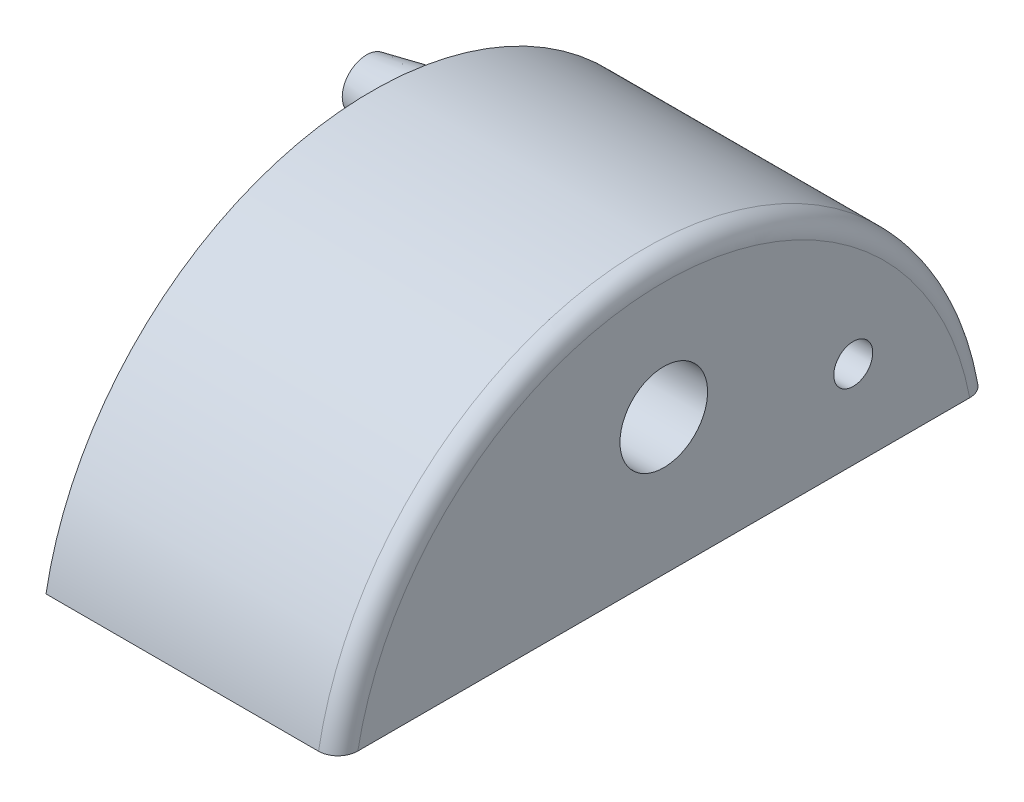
SolidWorks part; units mm, degrees
ref_plane "Front Plane" through (0, 0, 0) normal (0, 0, 1) x (1, 0, 0)
ref_plane "Top Plane" through (0, 0, 0) normal (0, 1, 0) x (1, 0, 0)
ref_plane "Right Plane" through (0, 0, 0) normal (1, 0, 0) x (0, 0, -1)
sketch "Sketch1" plane through (0, 0, 0) normal (1, 0, 0) x (0, 0, -1)
  line L0 (-20, 0) -> (20, 0) construction
  line L1 (-16.7332, 3) -> (16.7332, 3)
  arc A0 (-20, 0) -> (20, 0) centre (0, 0) cw construction
  arc A1 (-16.7332, 3) -> (16.7332, 3) centre (0, 0) cw
  point P4 (0, 0)
  dimension "D1" = 40
  dimension "D2" = 3
extrude "Boss-Extrude1" add sketch "Sketch1" along normal blind 15
sketch "Sketch2" plane through (0, 0, 0) normal (-1, 0, 0) x (0, 0, 1)
  line L0 (0, 3) -> (0, 17) construction
  line L1 (16.7332, 3) -> (-16.7332, 3) construction
  circle A0 centre (0, 10) radius 2.25
  arc A1 (16.7332, 3) -> (-16.7332, 3) centre (0, 0) ccw construction
  point P12 (0, 10)
  dimension "D1" = 4.5
extrude "Cut-Extrude1" cut sketch "Sketch2" against normal through all
fillet "Fillet1" radius 1 1 edges at (15, 17, 0)
sketch "Sketch3" plane through (0, 0, 0) normal (-1, 0, 0) x (0, 0, 1)
  line L0 (16.7332, 3) -> (-16.7332, 3) construction
  circle A0 centre (-9.7332, 7.5) radius 2.25
  dimension "D2" = 4.5
  dimension "D1" = 4.5
  dimension "D3" = 7
extrude "Boss-Extrude2" add sketch "Sketch3" along normal blind 10
chamfer "Chamfer1" distance 5 distance2 1 1 edges at (-10, 7.5, -7.4832)
sketch "Sketch4" plane through (-10, 0, 0) normal (-1, 0, 0) x (0, 0, 1)
  circle A0 centre (-9.7332, 7.5) radius 1
  dimension "D1" = 2
extrude "Cut-Extrude2" cut sketch "Sketch4" against normal through all
